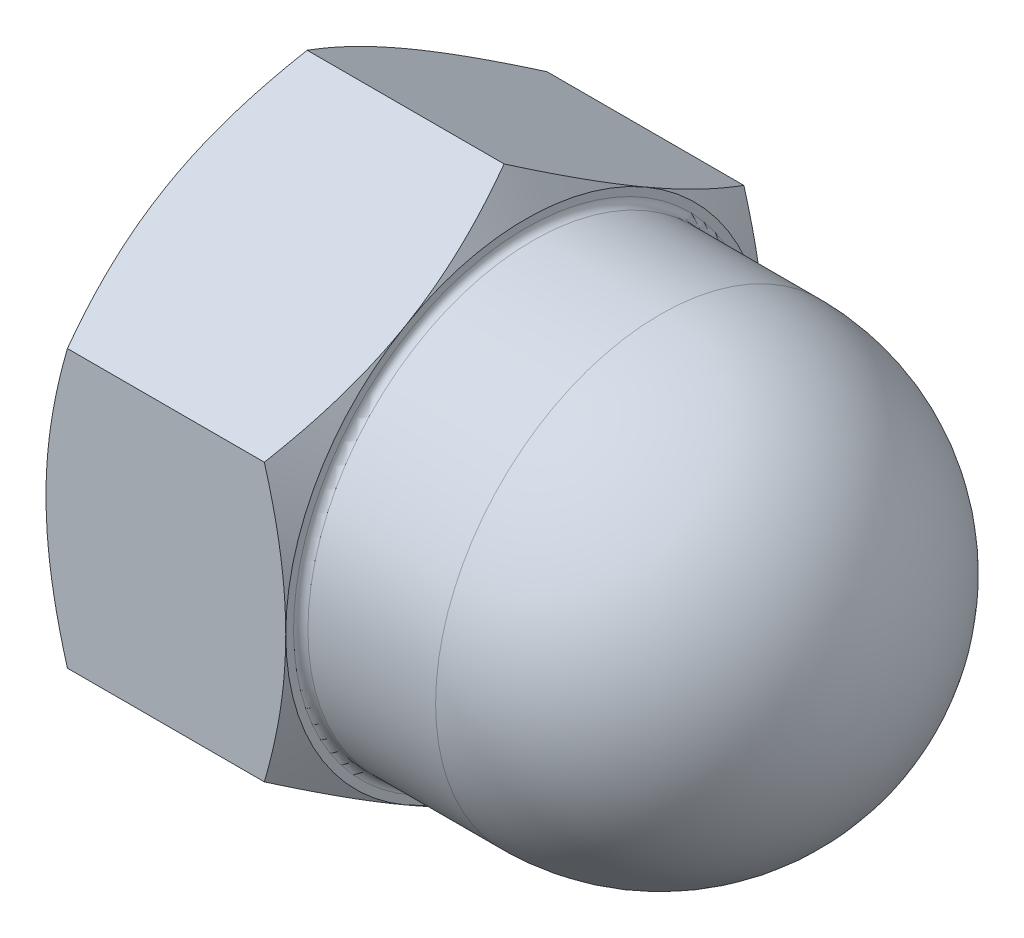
SolidWorks part; units mm, degrees
ref_plane "Plane1" through (0, 0, 0) normal (0, 0, 1) x (1, 0, 0)
ref_plane "Plane2" through (0, 0, 0) normal (0, 1, 0) x (1, 0, 0)
ref_plane "Plane3" through (0, 0, 0) normal (1, 0, 0) x (0, 0, -1)
sketch "BaseNutSke" plane through (0, 0, 0) normal (1, 0, 0) x (0, 0, -1)
  line L6 (4, 2.3094) -> (4, -2.3094)
  line L7 (-4, 2.3094) -> (-4, -2.3094)
  line L8 (4, 2.3094) -> (0, 4.6188)
  line L9 (0, 4.6188) -> (-4, 2.3094)
  line L10 (-4, -2.3094) -> (0, -4.6188)
  line L11 (0, -4.6188) -> (4, -2.3094)
  dimension "D4" = 60
  dimension "D1" = 120
  dimension "D2" = 4
  dimension "D3" = 4
  dimension "Width_flats" = 8
extrude "BaseNut" add sketch "BaseNutSke" along normal blind 4
sketch "DomeSke" plane through (0, 0, 0) normal (0, 0, 1) x (1, 0, 0)
  line L0 (0, 0) -> (63.5, 0) construction
  line L1 (0, 2.3094) -> (0, -2.3094) construction
  line L2 (10, 0) -> (0, 0)
  line L3 (0, 3.75) -> (6.25, 3.75)
  line L4 (0, -3.75) -> (22.225, -14) construction
  line L5 (0, 3.75) -> (0, 0)
  arc A0 (6.25, 3.75) -> (10, 0) centre (6.25, 0) cw
  dimension "Dome_rad" = 3.75
  dimension "Overall_ht" = 10
revolve "Dome" add sketch "DomeSke" angle 360 about L0
sketch "Sketch4" plane through (0, 0, 0) normal (0, 0, 1) x (1, 0, 0)
  line L0 (0, 4) -> (0.7422, 5.2855)
  line L1 (4, 4) -> (3.2578, 5.2855)
  line L2 (0.7422, 5.2855) -> (3.2578, 5.2855)
  line L3 (4, 4) -> (6, 4)
  line L4 (6, 4) -> (6, 19)
  line L5 (6, 19) -> (-2, 19)
  line L6 (0, 4) -> (-2, 4)
  line L7 (-2, 4) -> (-2, 19)
  line L8 (4, 4.6188) -> (4, 2.3094) construction
  line L9 (0, 4.6188) -> (0, 2.3094) construction
  line L10 (0, 0) -> (57.15, 0) construction
  line L11 (4, 4.6188) -> (0, 4.6188) construction
  point P17 (4, 4)
  dimension "D1" = 30
  dimension "D2" = 30
  dimension "D3" = 2
  dimension "D4" = 2
  dimension "D5" = 0.6667
  dimension "D6" = 15
  dimension "D7" = 4
revolve "DoubleChamfer" cut sketch "Sketch4" angle 360 about L10
sketch "TapDriSke" plane through (0, 0, 0) normal (0, 0, 1) x (1, 0, 0)
  line L0 (0, 0) -> (44.45, 0) construction
  line L1 (0, 2.1) -> (6.5, 2.1)
  line L2 (0, 3.4641) -> (0, 0) construction
  line L3 (6.5, 2.1) -> (7.7618, 0)
  line L4 (0, 0) -> (63.5, 0) construction
  line L5 (7.7618, 0) -> (0, 0)
  line L6 (0, 0) -> (0, 2.1)
  line L7 (6.5, -2.1) -> (7.7618, 0) construction
  line L8 (0, -2.1) -> (6.5, -2.1) construction
  line L9 (1, 6.35) -> (1, 3.175) construction
  dimension "TPA" = 118
  dimension "Thread_min" = 4.2
  dimension "Drill_depth" = 6.5
  dimension "Drill_clr" = 2
revolve "TapDrill" cut sketch "TapDriSke"
revolve "EndChamfer" cut sketch "EndChamferSketch" angle 360 about L4
sketch "EndChamferSketch" plane through (0, 0, 0) normal (0, 0, 1) x (1, 0, 0)
  line L0 (-0.0254, 2.5) -> (0.0254, 2.5)
  line L1 (0.0254, 2.5) -> (0.3335, 2.06)
  line L2 (0.3335, 2.06) -> (-0.0254, 2.06)
  line L3 (-0.0254, 2.06) -> (-0.0254, 2.5)
  line L4 (0, 0) -> (-15.875, 0) construction
  dimension "D1" = 0.0508
  dimension "D2" = 35
  dimension "D3" = 0.0254
  dimension "ChamferDepth" = 0.44
  dimension "ThreadMajor" = 2.5
revolve "Undercut" cut sketch "UcutSke" angle 360 about L0
sketch "UcutSke" plane through (0, 0, 0) normal (0, 0, 1) x (1, 0, 0)
  line L0 (0, 0) -> (38.1, 0) construction
  line L1 (5.3554, 2.525) -> (5.11, 2.1)
  line L2 (5.11, 0.25) -> (6.71, 0.25)
  line L3 (6.71, 0.25) -> (6.71, 2.525)
  line L4 (6.71, 2.525) -> (5.3554, 2.525)
  line L5 (5.11, 0.25) -> (5.11, 2.1)
  line L6 (6.5, 2.1) -> (0, 2.1) construction
  line L7 (0, 3.4641) -> (0, 0) construction
  dimension "D1" = 0.5
  dimension "D2" = 240
  dimension "Ucut_dia" = 5.05
  dimension "Ucut_dep" = 6.71
  dimension "Ucut_wid" = 1.6
sketch "ThdSchSke" plane through (0, 0, 0) normal (0, 1, 0) x (1, 0, 0)
  line L0 (0.0381, 2.5) -> (-0.242, 2.1)
  line L1 (-0.242, 2.1) -> (-0.242, 1.05)
  line L2 (-0.242, 1.05) -> (0.3182, 1.05)
  line L3 (0.3182, 1.05) -> (0.3182, 2.1)
  line L4 (0.3182, 2.1) -> (0.0381, 2.5)
  line L5 (-38.1, 0) -> (3.175, 0) construction
  line L6 (0, 0) -> (-15.875, 0) construction
  line L7 (0, 0) -> (63.5, 0) construction
  line L9 (0.8381, -7.025) -> (0.8381, -13.375) construction
  dimension "D1" = 0.0381
  dimension "VeeAngle" = 70
  dimension "SideAngle" = 55
  dimension "Thread_major" = 5
  dimension "Tap_drill" = 4.2
  dimension "OverCut" = 2.1
  dimension "Advance" = 0.8
revolve "ThreadSchematic" [suppressed] cut sketch "ThdSchSke" angle 360 about L5
pattern_linear "ThdSchPat" [suppressed]
fillet "DomeFillet" radius 0.12 1 edges at (4, 0, 3.75)
equation "' \"Width_flats@BaseNutSke\" = 30"
equation "' \"Hex_ht@BaseNut\" = 16"
equation "' \"Overall_ht@DomeSke\" = 34"
equation "' \"Dome_rad@DomeSke\" = 14"
equation "' \"Thread_min@TapDriSke\" = 17.5"
equation "' \"Drill_clr@TapDriSke\" = 5.0"
equation "' \"Advance@ThdSchSke\" = 2.5"
equation "' \"Thread_nominal@ThreadCosmetic\" = 20"
equation "' \"Radius@DomeFillet\" = 0.5"
equation "' \"Ucut_wid@UcutSke\" = 9.3"
equation "' \"Ucut_dep@UcutSke\" = 26.42"
equation "\"Drill_depth@TapDriSke\" = \"Overall_ht@DomeSke\"  - \"Drill_clr@TapDriSke\" - 0.3 * \"Thread_nominal@ThreadCosmetic\""
equation "\"Ucut_dia@UcutSke\" = \"Thread_nominal@ThreadCosmetic\" * 1.01"
equation "\"Thread_depth@ThreadCosmetic\" = \"Ucut_dep@UcutSke\" - \"Ucut_wid@UcutSke\" + ( \"Thread_nominal@ThreadCosmetic\" - \"Thread_min@TapDriSke\" ) / 2 * 0.57735"
equation "\"D2@BaseNutSke\" = \"Width_flats@BaseNutSke\" / 2"
equation "\"D3@BaseNutSke\" = \"Width_flats@BaseNutSke\" / 2"
equation "\"D7@Sketch4\" = \"Width_flats@BaseNutSke\" / 2"
equation "\"D5@Sketch4\" = \"Width_flats@BaseNutSke\" / 12"
equation "\"Thread_major@ThdSchSke\" = \"Thread_nominal@ThreadCosmetic\""
equation "\"Tap_drill@ThdSchSke\" = \"Thread_min@TapDriSke\""
equation "\"Overcut@ThdSchSke\" = \"Tap_drill@ThdSchSke\" * 0.5"
equation "\"Num_threads@ThdSchPat\" = int(  ( \"Thread_depth@ThreadCosmetic\" - 0.002 ) / \"Advance@ThdSchSke\" + 0.999 )  + 1"
equation "\"Advance@ThdSchPat\" = ( \"Thread_depth@ThreadCosmetic\" - 0.002 ) /  (\"Num_threads@ThdSchPat\" - 1) 'relax it"
equation "\"ThreadMajor@EndChamferSketch\" = \"Thread_nominal@ThreadCosmetic\" * 0.5"
equation "\"ChamferDepth@EndChamferSketch\" = (\"Thread_nominal@ThreadCosmetic\" - \"Thread_min@TapDriSke\") * 0.55"
